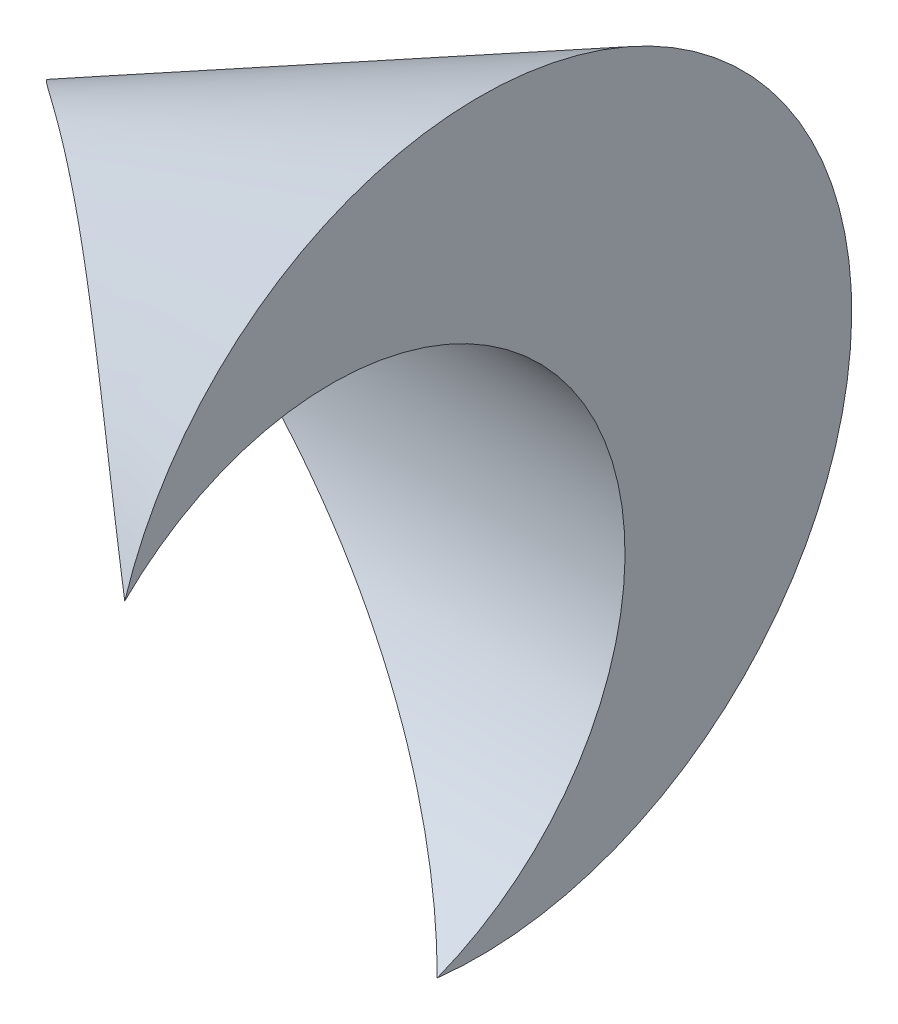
SolidWorks part; units mm, degrees
ref_plane "前视基准面" through (0, 0, 0) normal (0, 0, 1) x (1, 0, 0)
ref_plane "上视基准面" through (0, 0, 0) normal (0, 1, 0) x (1, 0, 0)
ref_plane "右视基准面" through (0, 0, 0) normal (1, 0, 0) x (0, 0, -1)
sketch "草图1" plane through (0, 0, 0) normal (0, 0, 1) x (1, 0, 0)
  line L0 (-69.2897, 0) -> (66.675, 0) construction
  line L1 (-47.9985, 0) -> (2.0015, 25)
  line L2 (2.0015, 25) -> (2.0015, 0)
  line L3 (-47.9985, 0) -> (2.0015, 0)
  dimension "D1" = 50
  dimension "D2" = 25
revolve "旋转1" add sketch "草图1" angle 360 about L0
sketch "草图3" plane through (2.0015, 0, 0) normal (1, 0, 0) x (0, 0, -1)
  circle A0 centre (-9.9481, -6.4398) radius 19.7236
extrude "切除-拉伸2" cut sketch "草图3" against normal up to vertex
